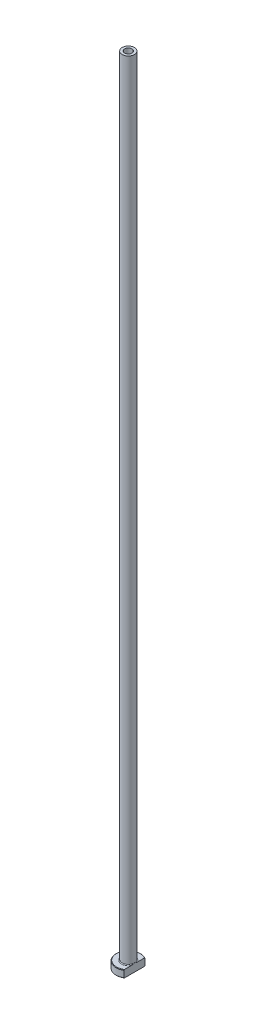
SolidWorks part; units mm, degrees
ref_plane "Front Plane" through (0, 0, 0) normal (0, 0, 1) x (1, 0, 0)
ref_plane "Top Plane" through (0, 0, 0) normal (0, 1, 0) x (1, 0, 0)
ref_plane "Right Plane" through (0, 0, 0) normal (1, 0, 0) x (0, 0, -1)
sketch "Sketch1" plane through (0, 0, 0) normal (0, 0, 1) x (1, 0, 0)
  line L0 (-1.5, 325) -> (-2.5, 325)
  line L1 (-2.5, 325) -> (-2.5, 3)
  line L2 (-2.5, 3) -> (-5, 3)
  line L3 (-5, 3) -> (-5, 0)
  line L4 (4.125, 0) -> (-4.125, 0) construction
  line L5 (-5, 0) -> (-1.75, 0)
  line L6 (-1.5, 280) -> (-1.5, 325)
  line L7 (0, 92.1877) -> (0, -15.5353) construction
  line L8 (0, -5.5) -> (0, 5.5) construction
  line L9 (-1.5, 280) -> (-1.75, 268)
  line L10 (-1.75, 268) -> (-1.75, 0)
  dimension "D1" = 0.25
  dimension "ID" = 3
  dimension "OD" = 5
  dimension "L" = 325
  dimension "H" = 10
  dimension "T" = 3
  dimension "N" = 45
  dimension "D2" = 12
  dimension "L-N" = 280
revolve "Revolve1" add sketch "Sketch1" angle 360 about L7
fillet "Fillet1" radius 0.3 1 edges at (0, 3, 2.5)
chamfer "Chamfer1" distance 0.2 angle 45 2 edges at (0, 3, 5) (0, 0, 5)
sketch "Sketch2" plane through (0, 0, 0) normal (0, -1, 0) x (1, 0, 0)
  line L0 (2.5, 4.3301) -> (2.5, -4.3301)
  circle A0 centre (0, 0) radius 5 construction
  arc A1 (2.5, 4.3301) -> (2.5, -4.3301) centre (0, 0) cw
  circle A2 centre (0, 0) radius 2.5 construction
extrude "Cut-Extrude1" cut sketch "Sketch2" against normal through all
chamfer "Chamfer2" distance 0.5 angle 45 1 edges at (0, 0, 1.75)
